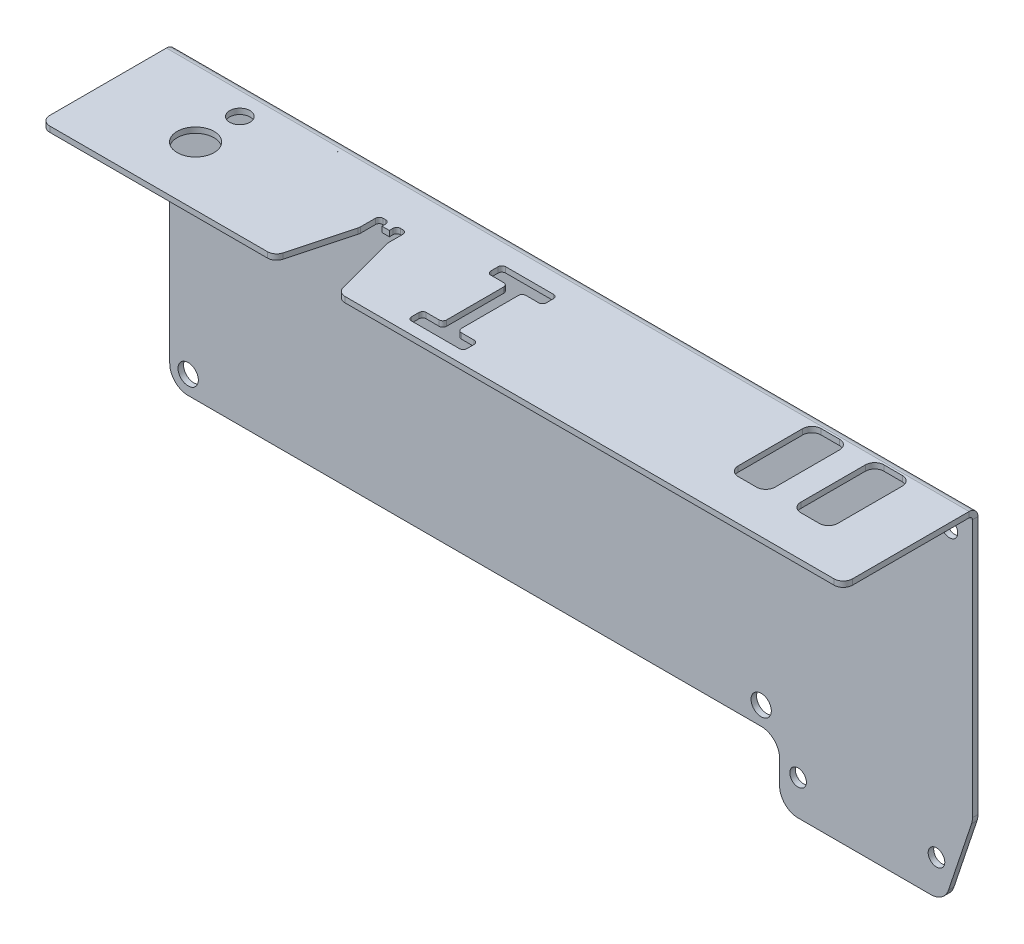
SolidWorks part; units mm, degrees
ref_plane "Plan1" through (0, 0, 0) normal (0, 0, 1) x (1, 0, 0)
ref_plane "Plan2" through (0, 0, 0) normal (0, 1, 0) x (1, 0, 0)
ref_plane "Plan3" through (0, 0, 0) normal (1, 0, 0) x (0, 0, -1)
sketch "Esquisse1" plane through (0, 0, 0) normal (0, 0, 1) x (1, 0, 0)
  line L0 (0, 157.1) -> (435, 157.1) construction
  line L1 (165.0744, 228.2) -> (180, 228.2)
  line L2 (0, 223.2) -> (0, 10)
  line L3 (10, 0) -> (320.5, 0)
  line L4 (52, 196.2) -> (52, 172.2) construction
  line L5 (136.5, 191.2) -> (136.5, 183.2)
  line L6 (138.5, 181.2) -> (140, 181.2)
  line L7 (5, 228.2) -> (122.9256, 228.2)
  line L8 (151.5, 191.2) -> (151.5, 183.2)
  line L9 (374.5, 10) -> (10, 10) construction
  line L10 (292.29, -14) -> (415.5, -14) construction
  line L11 (378, 44.3) -> (378, -33) construction
  line L12 (151.6704, 192.4941) -> (160.2447, 224.4941)
  line L13 (136.3296, 192.4941) -> (127.7553, 224.4941)
  line L14 (435, 223.2) -> (435, 14.3925)
  line L15 (412.4886, -33) -> (340.5, -33)
  line L16 (330.5, -10) -> (330.5, -23)
  line L17 (434.4832, 11.2195) -> (421.9719, -26.173)
  line L19 (148, 181.2) -> (149.5, 181.2)
  line L20 (180, 228.2) -> (430, 228.2)
  line L22 (378, 181) -> (378, 157.1) construction
  line L23 (144, 191.2) -> (144, 157.1) construction
  line L24 (156.5, 191.2) -> (131.5, 191.2) construction
  line L25 (204.7, 217.7) -> (240.1, 217.7) construction
  line L26 (213.5, 213.7) -> (220.5, 213.7)
  line L27 (203.5, 211.7) -> (203.5, 180.7)
  line L28 (222.5, 176.7) -> (222.5, 172.7)
  line L29 (211.5, 211.7) -> (211.5, 180.7)
  line L30 (194.5, 213.7) -> (201.5, 213.7)
  line L31 (146, 183.2) -> (146, 185.2)
  line L32 (146, 185.2) -> (142, 185.2)
  line L33 (390, 206.2) -> (400, 206.2)
  line L34 (385, 201.2) -> (385, 166.2)
  line L35 (390, 161.2) -> (400, 161.2)
  line L36 (405, 201.2) -> (405, 166.2)
  line L37 (356, 206.2) -> (366, 206.2)
  line L38 (351, 201.2) -> (351, 166.2)
  line L39 (356, 161.2) -> (366, 161.2)
  line L40 (371, 201.2) -> (371, 166.2)
  line L41 (142, 183.2) -> (142, 185.2)
  line L42 (192.5, 215.7) -> (192.5, 219.7)
  line L43 (194.5, 170.7) -> (220.5, 170.7)
  line L44 (194.5, 221.7) -> (220.5, 221.7)
  line L45 (222.5, 215.7) -> (222.5, 219.7)
  line L46 (192.5, 176.7) -> (192.5, 172.7)
  line L47 (194.5, 178.7) -> (201.5, 178.7)
  line L48 (213.5, 178.7) -> (220.5, 178.7)
  line L51 (212.9, 196.2) -> (229.6, 196.2) construction
  line L54 (207.5, 196.2) -> (207.5, 219.5295) construction
  arc A0 (320.5, 0) -> (330.5, -10) centre (320.5, -10) cw
  circle A1 centre (52, 172.2) radius 5.5
  circle A2 centre (52, 196.2) radius 10
  circle A3 centre (10, 10) radius 5.5
  circle A5 centre (340.5, -14) radius 4.5
  circle A6 centre (415.5, -14) radius 4.5
  arc A7 (434.4832, 11.2195) -> (435, 14.3925) centre (425, 14.3925) ccw
  arc A8 (412.4886, -33) -> (421.9719, -26.173) centre (412.4886, -23) ccw
  arc A10 (10, 0) -> (0, 10) centre (10, 10) cw
  arc A11 (340.5, -33) -> (330.5, -23) centre (340.5, -23) cw
  arc A12 (165.0744, 228.2) -> (160.2447, 224.4941) centre (165.0744, 223.2) ccw
  arc A13 (122.9256, 228.2) -> (127.7553, 224.4941) centre (122.9256, 223.2) cw
  arc A14 (0, 223.2) -> (5, 228.2) centre (5, 223.2) cw
  arc A15 (430, 228.2) -> (435, 223.2) centre (430, 223.2) cw
  arc A16 (151.6704, 192.4941) -> (151.5, 191.2) centre (156.5, 191.2) ccw
  arc A17 (136.3296, 192.4941) -> (136.5, 191.2) centre (131.5, 191.2) cw
  arc A18 (138.5, 181.2) -> (136.5, 183.2) centre (138.5, 183.2) cw
  circle A19 centre (422.5, 144) radius 4.5
  arc A20 (149.5, 181.2) -> (151.5, 183.2) centre (149.5, 183.2) ccw
  arc A21 (148, 181.2) -> (146, 183.2) centre (148, 183.2) cw
  arc A22 (351, 201.2) -> (356, 206.2) centre (356, 201.2) cw
  arc A23 (366, 206.2) -> (371, 201.2) centre (366, 201.2) cw
  arc A24 (211.5, 211.7) -> (213.5, 213.7) centre (213.5, 211.7) cw
  arc A25 (201.5, 213.7) -> (203.5, 211.7) centre (201.5, 211.7) cw
  arc A26 (192.5, 215.7) -> (194.5, 213.7) centre (194.5, 215.7) ccw
  arc A27 (194.5, 221.7) -> (192.5, 219.7) centre (194.5, 219.7) ccw
  arc A28 (356, 161.2) -> (351, 166.2) centre (356, 166.2) cw
  arc A29 (371, 166.2) -> (366, 161.2) centre (366, 166.2) cw
  arc A30 (385, 201.2) -> (390, 206.2) centre (390, 201.2) cw
  arc A31 (390, 161.2) -> (385, 166.2) centre (390, 166.2) cw
  arc A32 (405, 166.2) -> (400, 161.2) centre (400, 166.2) cw
  arc A33 (400, 206.2) -> (405, 201.2) centre (400, 201.2) cw
  arc A34 (140, 181.2) -> (142, 183.2) centre (140, 183.2) ccw
  circle A35 centre (320.5, 10) radius 5.5
  arc A36 (222.5, 219.7) -> (220.5, 221.7) centre (220.5, 219.7) ccw
  arc A37 (220.5, 213.7) -> (222.5, 215.7) centre (220.5, 215.7) ccw
  arc A38 (220.5, 178.7) -> (222.5, 176.7) centre (220.5, 176.7) cw
  arc A39 (222.5, 172.7) -> (220.5, 170.7) centre (220.5, 172.7) cw
  arc A40 (194.5, 170.7) -> (192.5, 172.7) centre (194.5, 172.7) cw
  arc A41 (192.5, 176.7) -> (194.5, 178.7) centre (194.5, 176.7) cw
  arc A42 (201.5, 178.7) -> (203.5, 180.7) centre (201.5, 180.7) ccw
  arc A43 (211.5, 180.7) -> (213.5, 178.7) centre (213.5, 180.7) ccw
  point P35 (435, -33)
  point P42 (0, 0)
  point P45 (330.5, -33)
  point P52 (0, 228.2)
  point P55 (435, 228.2)
  point P60 (151.5, 191.8583)
  point P63 (136.5, 191.8583)
  point P76 (136.5, 181.2)
  point P79 (151.5, 181.2)
  point P100 (203.5, 196.2)
  point P154 (211.5, 196.2)
  dimension "D5" = 9
  dimension "D8" = 11
  dimension "D14" = 20
  dimension "D15" = 134
  dimension "D23" = 71.5
  dimension "D25" = 10
  dimension "D28" = 4
  dimension "D29" = 10
  dimension "D30" = 15
  dimension "D31" = 5
  dimension "D33" = 4
  dimension "D34" = 5
  dimension "D35" = 5
  dimension "D36" = 2
  dimension "D37" = 8
  dimension "D6" = 10
  dimension "D39" = 14
  dimension "D43" = 8
  dimension "D7" = 11
  dimension "D46" = 10
  dimension "D45" = 21.5
  dimension "D52" = 5
  dimension "D17" = 12.5
  dimension "D48" = 32
  dimension "D54" = 9
  dimension "D53" = 2
  dimension "D1" = 435
  dimension "D2" = 71.1
  dimension "D3" = 32
  dimension "D4" = 104.5
  dimension "D9" = 52
  dimension "D10" = 47
  dimension "D11" = 15
  dimension "D12" = 144
  dimension "D13" = 56
  dimension "D16" = 10
  dimension "D18" = 10
  dimension "D19" = 19
  dimension "D21" = 57
  dimension "D22" = 75
  dimension "D24" = 261.2
  dimension "D32" = 10
  dimension "D38" = 22
  dimension "D40" = 20
  dimension "D41" = 57
  dimension "D42" = 30
  dimension "D44" = 207.5
  dimension "D47" = 147.1
  dimension "D49" = 20
  dimension "D50" = 30
  dimension "D51" = 45
extrude "Base-Extrusion" add sketch "Esquisse1" along normal blind 3
sheet metal parameters "Tôlerie 2" parameters "D1"=3, "Epaisseur"=3
flatten bends "Dépliage 2" parameters "D1"=3
sketch "Esquisse-Angle2" plane through (0, 0, 3) normal (0, 0, 1) x (1, 0, 0)
process bends "Pliage 2" parameters "D1"=1.8
sketch "Esquisse-Plate2" plane through (0, 0, 3) normal (0, 0, 1) x (1, 0, 0)
  line L0 (-30, 157.1) -> (471.5974, 157.1)
  line L1 (430, 228.2) -> (165.0744, 228.2) construction
  line L2 (430, 228.2) -> (165.0744, 228.2) construction
  circle A1 centre (52, 172.2) radius 5.5 construction
  point P2 (217.5, 70.1)
  dimension "D2" = 15.1
  dimension "D1" = 71.1
bend "Pli défini à plat1" bend radius 1.8 bend angle 90 parameters "D5"=1
